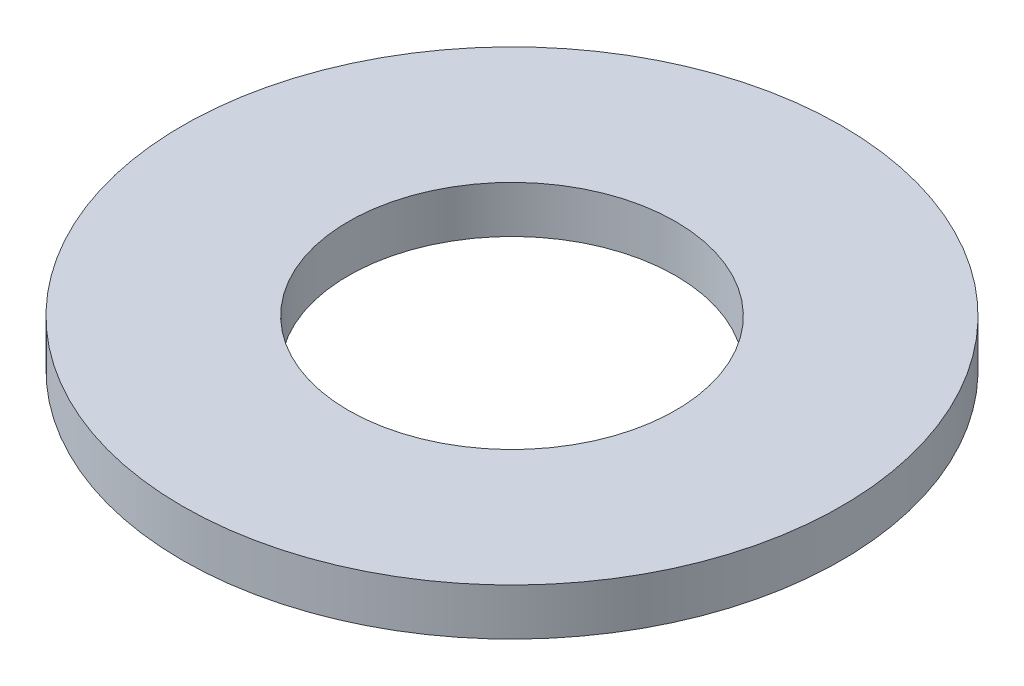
SolidWorks part; units mm, degrees
ref_plane "Front Plane" through (0, 0, 0) normal (0, 0, 1) x (1, 0, 0)
ref_plane "Top Plane" through (0, 0, 0) normal (0, 1, 0) x (1, 0, 0)
ref_plane "Right Plane" through (0, 0, 0) normal (1, 0, 0) x (0, 0, -1)
sketch "Sketch1" plane through (0, 0, 0) normal (0, 1, 0) x (1, 0, 0)
  line L0 (-2.2753, 3.2898) -> (2.2753, 3.2898) construction
  line L1 (0, -4) -> (0, 3.2898) construction
  arc A0 (2.2753, 3.2898) -> (-2.2753, 3.2898) centre (0, 0) cw construction
  circle A1 centre (0, 0) radius 5.2373
  circle A2 centre (0, 0) radius 4 construction
  circle A3 centre (0, 0) radius 10.55
  dimension "D1" = 10.4746
  dimension "D3" = 8
  dimension "D4" = 21.1
  dimension "D2" = 7.2898
extrude "Boss-Extrude1" add sketch "Sketch1" along normal blind 1.5
